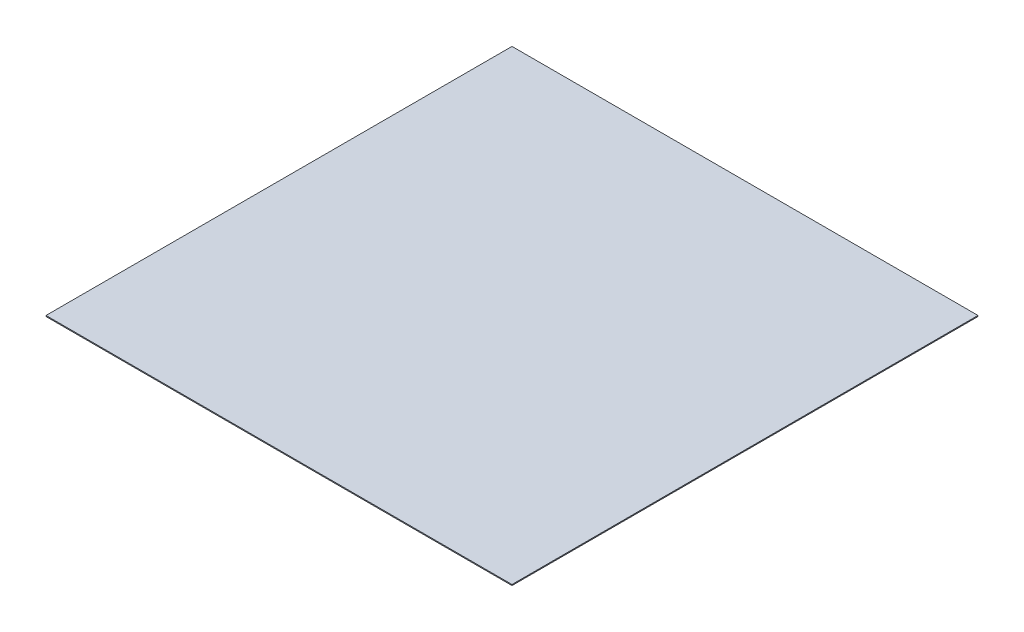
SolidWorks part; units mm, degrees
ref_plane "Front" through (0, 0, 0) normal (0, 0, 1) x (1, 0, 0)
ref_plane "Top" through (0, 0, 0) normal (0, 1, 0) x (1, 0, 0)
ref_plane "Right" through (0, 0, 0) normal (1, 0, 0) x (0, 0, -1)
sketch "Sketch1" plane through (0, 0, 0) normal (0, 0, 1) x (1, 0, 0)
  line L0 (-304.8, 0) -> (304.8, 0)
  dimension "D1" = 609.6
extrude "Base-Extrude-Thin" add sketch "Sketch1" along normal mid plane 609.6 thin
